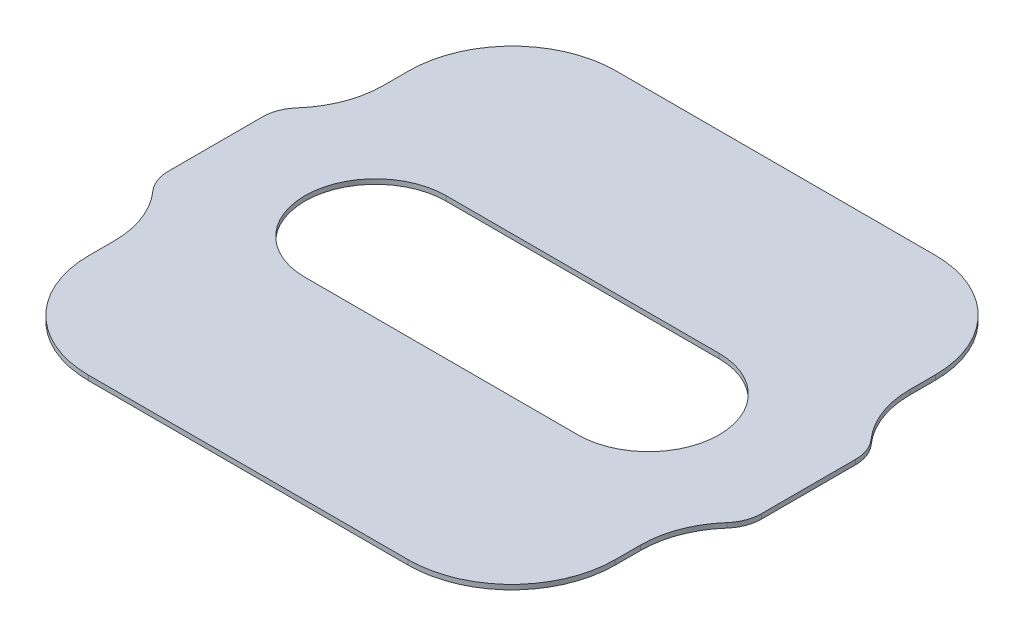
SolidWorks part; units mm, degrees
ref_plane "Front Plane" through (0, 0, 0) normal (0, 0, 1) x (1, 0, 0)
ref_plane "Top Plane" through (0, 0, 0) normal (0, 1, 0) x (1, 0, 0)
ref_plane "Right Plane" through (0, 0, 0) normal (1, 0, 0) x (0, 0, -1)
sketch "Sketch3" plane through (0, 0, 0) normal (0, 1, 0) x (1, 0, 0)
  line L0 (20.6415, -3.0308) -> (17.2491, -3.0308)
  line L1 (21.7415, -4.1305) -> (21.7415, -4.4007)
  line L2 (22.0953, -5.3308) -> (22.0953, -6.3308)
  line L3 (18.9453, -3.0308) -> (18.9453, -8.6308) construction
  line L4 (22.0953, -5.8308) -> (15.7953, -5.8308) construction
  line L5 (15.7953, -5.3308) -> (15.7953, -6.3308)
  line L6 (16.1491, -4.1305) -> (16.149, -4.4007)
  line L7 (21.7415, -7.531) -> (21.7415, -7.2608)
  line L8 (20.6415, -8.6308) -> (17.2491, -8.6308)
  line L9 (16.1491, -7.531) -> (16.149, -7.2608)
  arc A0 (20.6415, -3.0308) -> (21.7415, -4.1305) centre (20.6415, -4.1308) cw
  arc A1 (21.7415, -4.4007) -> (21.9942, -5.065) centre (22.7415, -4.4005) ccw
  arc A2 (21.9942, -5.065) -> (22.0953, -5.3308) centre (21.6953, -5.3308) cw
  arc A3 (15.8963, -5.065) -> (15.7953, -5.3308) centre (16.1953, -5.3308) ccw
  arc A4 (16.149, -4.4007) -> (15.8963, -5.065) centre (15.149, -4.4005) cw
  arc A5 (17.2491, -3.0308) -> (16.1491, -4.1305) centre (17.2491, -4.1308) ccw
  arc A6 (21.9942, -6.5965) -> (22.0953, -6.3308) centre (21.6953, -6.3308) ccw
  arc A7 (21.7415, -7.2608) -> (21.9942, -6.5965) centre (22.7415, -7.261) cw
  arc A8 (20.6415, -8.6308) -> (21.7415, -7.531) centre (20.6415, -7.5308) ccw
  arc A9 (17.2491, -8.6308) -> (16.1491, -7.531) centre (17.2491, -7.5308) cw
  arc A10 (16.149, -7.2608) -> (15.8963, -6.5965) centre (15.149, -7.261) ccw
  arc A11 (15.8963, -6.5965) -> (15.7953, -6.3308) centre (16.1953, -6.3308) cw
  dimension "D1" = 3.3924
extrude "Boss-Extrude3" add sketch "Sketch3" along normal blind 0.0508
sketch "Sketch4" plane through (0, 0.0508, 0) normal (0, 1, 0) x (1, 0, 0)
  line L0 (15.7953, -5.8308) -> (22.0953, -5.8308) construction
  line L1 (15.7953, -5.3308) -> (15.7953, -6.3308) construction
  line L2 (22.0953, -6.3308) -> (22.0953, -5.3308) construction
  line L3 (17.4953, -5.8308) -> (20.3953, -5.8308) construction
  line L4 (17.4953, -5.0808) -> (20.3953, -5.0808)
  line L5 (17.4953, -6.5808) -> (20.3953, -6.5808)
  arc A0 (17.4953, -5.0808) -> (17.4953, -6.5808) centre (17.4953, -5.8308) ccw
  arc A1 (20.3953, -6.5808) -> (20.3953, -5.0808) centre (20.3953, -5.8308) ccw
  point P8 (18.9453, -5.8308)
  dimension "D1" = 0.75
  dimension "D2" = 2.9
extrude "Cut-Extrude2" cut sketch "Sketch4" against normal through all
